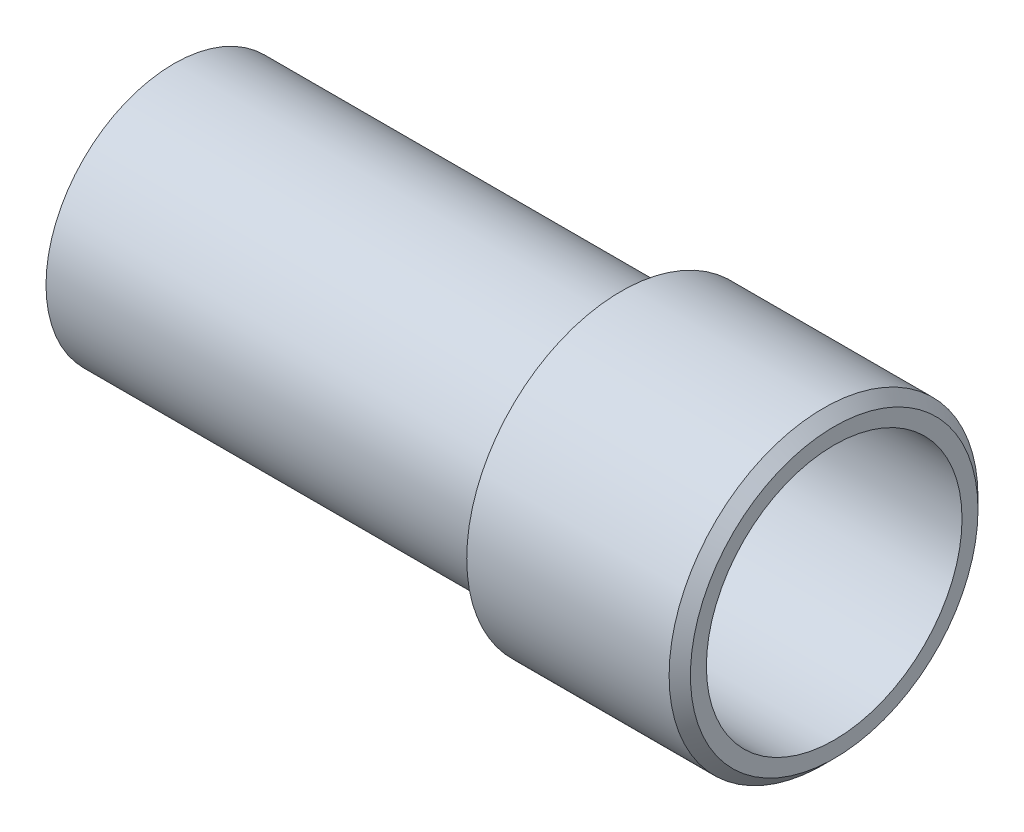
SolidWorks part; units mm, degrees
ref_plane "Alzado" through (0, 0, 0) normal (0, 0, 1) x (1, 0, 0)
ref_plane "Planta" through (0, 0, 0) normal (0, 1, 0) x (1, 0, 0)
ref_plane "Vista lateral" through (0, 0, 0) normal (1, 0, 0) x (0, 0, -1)
sketch "Croquis1" plane through (0, 0, 0) normal (1, 0, 0) x (0, 0, -1)
  circle A0 centre (0, 0) radius 7.25
  circle A1 centre (0, 0) radius 6
extrude "Saliente-Extruir1" add sketch "Croquis1" against normal blind 10
chamfer "Chaflán1" distance 0.5 angle 45 1 edges at (0, 0, -7.25)
sketch "Croquis2" plane through (-10, 0, 0) normal (-1, 0, 0) x (0, 0, 1)
  circle A0 centre (0, 0) radius 6 construction
  circle A1 centre (0, 0) radius 6
extrude "Saliente-Extruir2" add sketch "Croquis2" along normal blind 21 separate body
sketch "Croquis3" plane through (-10, 0, 0) normal (-1, 0, 0) x (0, 0, 1)
  circle A1 centre (0, 0) radius 7.25
  circle A2 centre (0, 0) radius 7.25
  dimension "D1" = 0
extrude "Saliente-Extruir4" [suppressed] add sketch "Croquis3" along normal blind 34 separate body
fillet "Redondeo1" [suppressed] radius 5
shell "Vaciado1" [suppressed] thickness 1.25
sketch "Croquis5" plane through (0, 0, 0) normal (0, 1, 0) x (1, 0, 0)
  line L3 (-34, 4.5) -> (-44, 4.5)
  line L4 (-44, 4.5) -> (-44, -4.5)
  line L5 (-34, -4.5) -> (-44, -4.5)
  arc A0 (-34, 4.5) -> (-34, -4.5) centre (-38.0625, 0) cw
  dimension "D1" = 9
extrude "Cortar-Extruir1" [suppressed] cut sketch "Croquis5" against normal mid plane 34
sketch "Croquis6" plane through (0, 0, 0) normal (0, 0, 1) x (1, 0, 0)
  circle A0 centre (-37.4651, 0) radius 2.5
extrude "Cortar-Extruir2" [suppressed] cut sketch "Croquis6" against normal mid plane 34
sketch "Croquis7" plane through (-10, 0, 0) normal (1, 0, 0) x (0, 0, -1)
  circle A0 centre (0, 0) radius 2.5
extrude "Cortar-Extruir3" cut sketch "Croquis7" against normal mid plane 60
